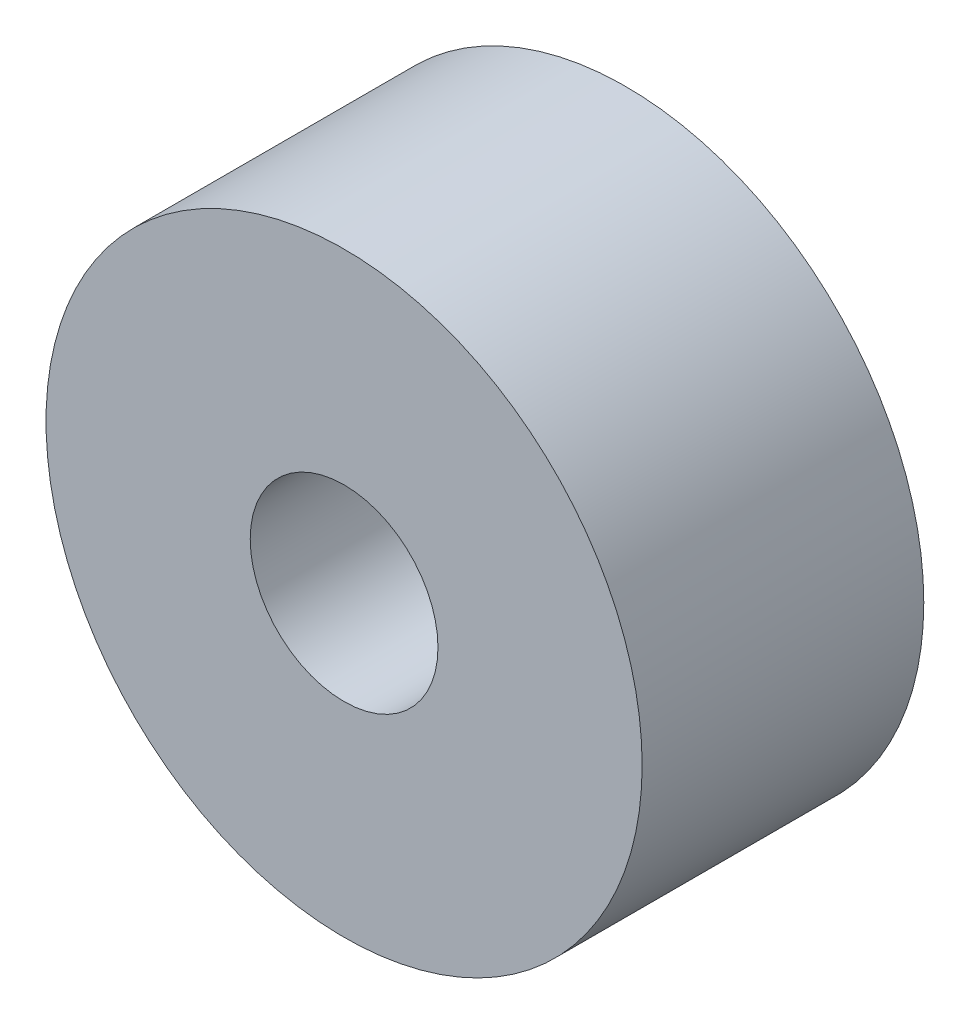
SolidWorks part; units mm, degrees
ref_plane "Front Plane" through (0, 0, 0) normal (0, 0, 1) x (1, 0, 0)
ref_plane "Top Plane" through (0, 0, 0) normal (0, 1, 0) x (1, 0, 0)
ref_plane "Right Plane" through (0, 0, 0) normal (1, 0, 0) x (0, 0, -1)
sketch "Sketch1" plane through (0, 0, 0) normal (0, 0, 1) x (1, 0, 0)
  circle A0 centre (0, 0) radius 1
  circle A1 centre (0, 0) radius 3.175
  dimension "D1" = 2
  dimension "D2" = 6.35
extrude "Boss-Extrude1" add sketch "Sketch1" along normal blind 3
